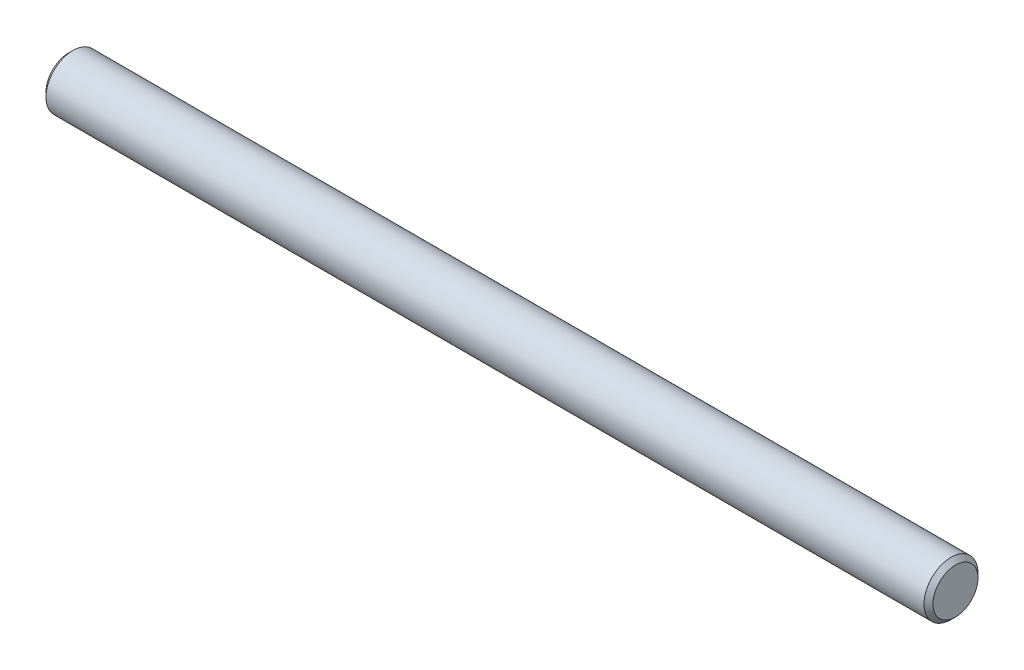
SolidWorks part; units mm, degrees
ref_plane "Front" through (0, 0, 0) normal (0, 0, 1) x (1, 0, 0)
ref_plane "Top" through (0, 0, 0) normal (0, 1, 0) x (1, 0, 0)
ref_plane "Right" through (0, 0, 0) normal (1, 0, 0) x (0, 0, -1)
sketch "Sketch1" plane through (0, 0, 0) normal (1, 0, 0) x (0, 0, -1)
  circle A0 centre (0, 0) radius 6
  dimension "D1" = 12
extrude "Extrude1" add sketch "Sketch1" along normal blind 197
chamfer "Chamfer1" distance 1 angle 45 2 edges at (0, 0, -6) (197, 0, -6)
